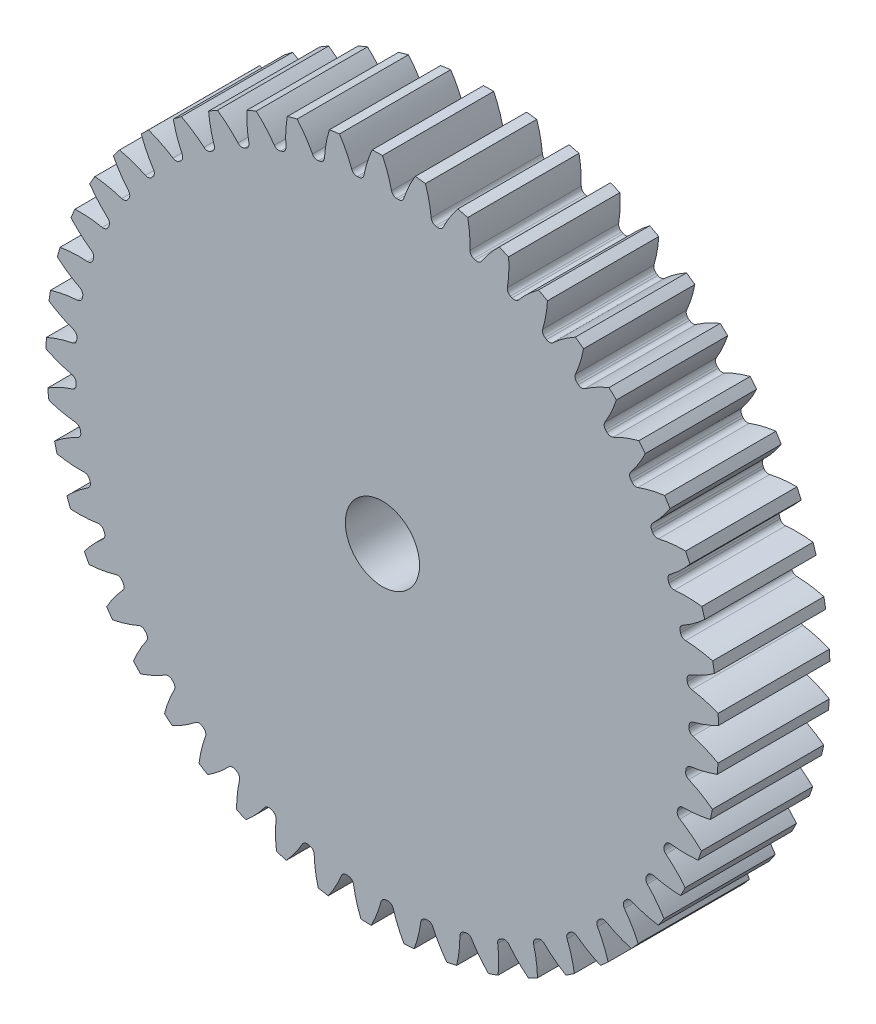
SolidWorks part; units mm, degrees
ref_plane "Front" through (0, 0, 0) normal (0, 0, 1) x (1, 0, 0)
ref_plane "Top" through (0, 0, 0) normal (0, 1, 0) x (1, 0, 0)
ref_plane "Right" through (0, 0, 0) normal (1, 0, 0) x (0, 0, -1)
sketch "Sketch3" plane through (0, 0, 0) normal (0, 0, 1) x (1, 0, 0)
  circle A0 centre (0, 0) radius 287.8667
  dimension "od" = 575.7333
extrude "gearBody" add sketch "Sketch3" along normal blind 95.25
sketch "Sketch2" plane through (0, 0, 0) normal (0, 0, 1) x (1, 0, 0)
  line L0 (0, 0) -> (240.1145, 99.4587) construction
  line L1 (287.3897, -19.003) -> (0, 0) construction
  line L2 (0, 0) -> (36.3143, 0) construction
  line L3 (276.5463, 4.1744) -> (276.2488, -13.4853) construction
  line L5 (276.3976, -4.6554) -> (0, 0) construction
  line L7 (0, 0) -> (259.8981, 0) construction
  arc A0 (259.8974, -0.6163) -> (259.7707, -8.1366) centre (0, 0) ccw construction
  arc A1 (287.7185, 9.2355) -> (287.2443, -18.9197) centre (0, 0) ccw construction
  arc A2 (276.5463, 4.1744) -> (276.2488, -13.4853) centre (0, 0) ccw construction
  arc A3 (262.4149, -5.2115) -> (262.4416, -3.6288) centre (0, 0) ccw
  arc A4 (287.3897, -19.003) -> (265.6993, -9.7068) centre (236.6289, -107.4886) ccw
  arc A5 (287.3897, -19.003) -> (287.8667, 9.3138) centre (0, 0) ccw
  arc A6 (287.8667, 9.3138) -> (265.8755, 0.7534) centre (240.1145, 99.4587) cw
  arc A7 (262.4416, -3.6288) -> (265.8755, 0.7534) centre (267.0357, -3.6923) cw
  arc A8 (265.6993, -9.7068) -> (262.4149, -5.2115) centre (267.0086, -5.3028) cw
  point P6 (287.8667, 9.3138)
  point P22 (287.3897, -19.003)
  dimension "baseDia" = 519.7962
  dimension "od" = 575.7333
  dimension "pd" = 553.1556
  dimension "rd" = 524.9333
  dimension "rFillet" = 4.5946
  dimension "pointX" = 287.8667
  dimension "pointY" = 9.3138
  dimension "CTT" = 17.6597
  dimension "flankCenterAngle" = 22.5
extrude "toothCut" cut sketch "Sketch2" along normal through all
pattern_circular "CirPattern1" count 49 over 360 about axis through (0, 0, 0) along (0, 0, 1) of "toothCut"
sketch "hub1Dia" plane through (0, 0, 0) normal (0, 0, -1) x (-1, 0, 0)
  circle A0 centre (0, 0) radius 12.7
  dimension "hub1Dia" = 25.4
sketch "hub2Dia" plane through (0, 0, 95.25) normal (0, 0, 1) x (1, 0, 0)
  circle A0 centre (0, 0) radius 12.7
  dimension "hub2dia" = 25.4
sketch "boreDia" plane through (0, 0, 0) normal (0, 0, 1) x (1, 0, 0)
  circle A0 centre (0, 0) radius 31.75
  dimension "boreDia" = 63.5
extrude "bore" cut sketch "boreDia" against normal mid plane 25400
